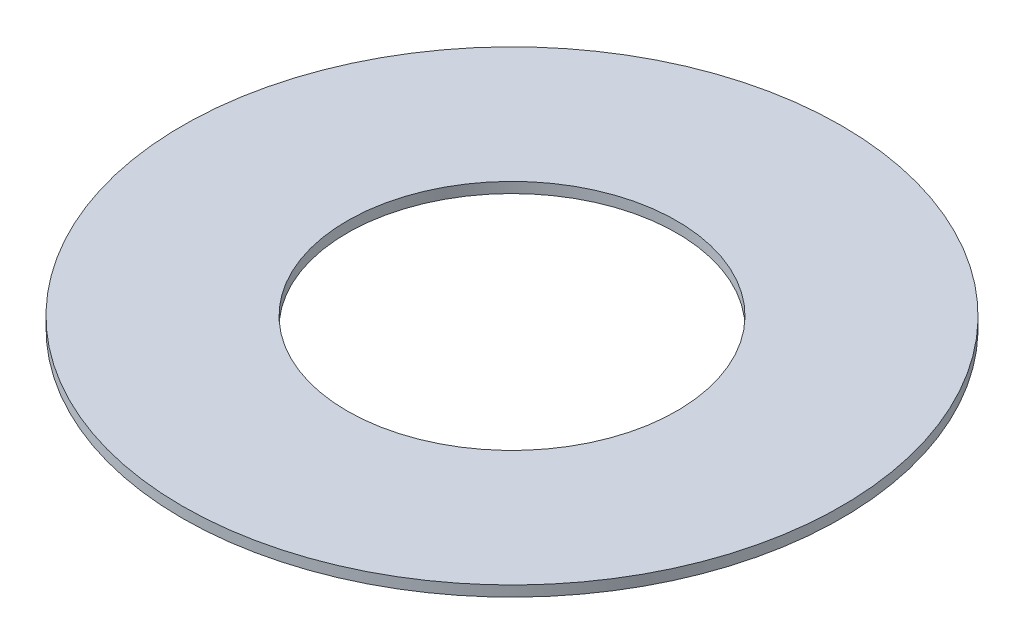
SolidWorks part; units mm, degrees
ref_plane "Front Plane" through (0, 0, 0) normal (0, 0, 1) x (1, 0, 0)
ref_plane "Top Plane" through (0, 0, 0) normal (0, 1, 0) x (1, 0, 0)
ref_plane "Right Plane" through (0, 0, 0) normal (1, 0, 0) x (0, 0, -1)
sketch "Sketch1" plane through (0, 0, 0) normal (0, 1, 0) x (1, 0, 0)
  circle A0 centre (0, 0) radius 3.175
  dimension "OD" = 6.35
extrude "Boss-Extrude1" add sketch "Sketch1" along normal blind 0.1016
sketch "Sketch5" plane through (0, 0.1016, 0) normal (0, 1, 0) x (-1, 0, 0)
  circle A0 centre (0, 0) radius 1.5875
  dimension "ID" = 3.175
extrude "Cut-Extrude1" cut sketch "Sketch5" against normal through all
